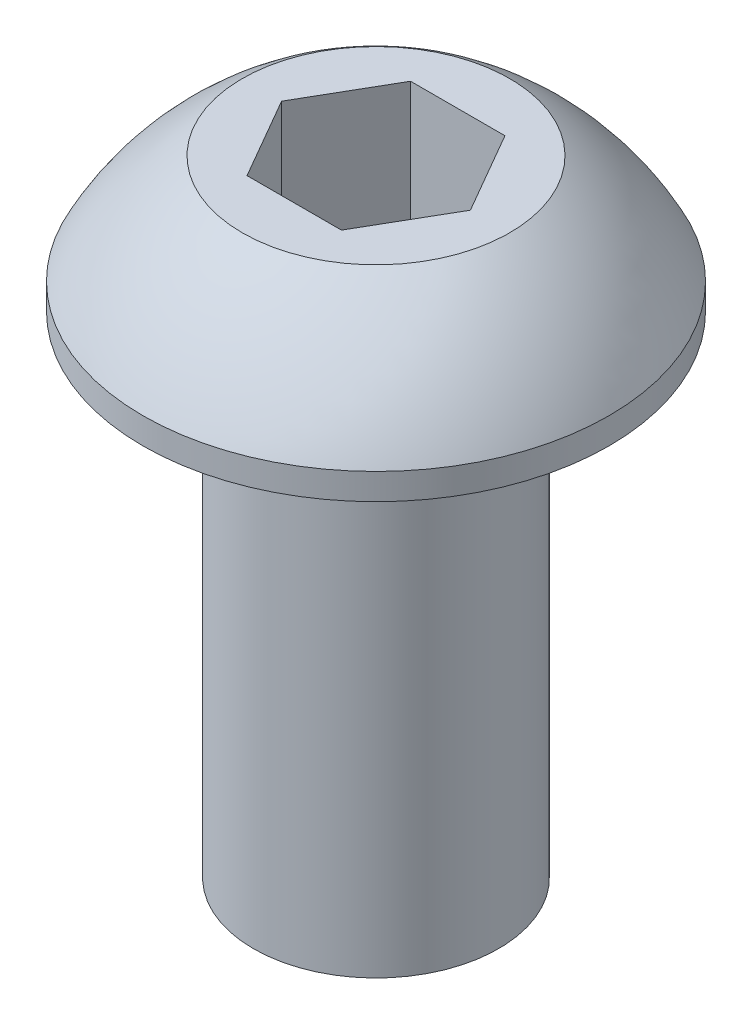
SolidWorks part; units mm, degrees
ref_plane "Front" through (0, 0, 0) normal (0, 0, 1) x (1, 0, 0)
ref_plane "Top" through (0, 0, 0) normal (0, 1, 0) x (1, 0, 0)
ref_plane "Right" through (0, 0, 0) normal (1, 0, 0) x (0, 0, -1)
sketch "profiile" plane through (0, 0, 0) normal (0, 0, 1) x (1, 0, 0)
  line L0 (0, 9.9072) -> (0, -20.7151) construction
  line L1 (0, 1.65) -> (1.635, 1.65)
  line L2 (2.85, 0.3202) -> (2.85, 0)
  line L3 (2.85, 0) -> (1.5, 0)
  line L4 (1.5, 0) -> (1.5, -6)
  line L5 (1.5, -6) -> (0, -6)
  line L6 (0, -6) -> (0, 1.65)
  arc A0 (1.635, 1.65) -> (2.85, 0.3202) centre (-0.1518, -1.2026) cw
  dimension "D1" = 5.7
  dimension "D2" = 1.65
  dimension "thread_length" = 6
  dimension "D4" = 3
revolve "Base-Revolve" add sketch "profiile" angle 360 about L0
sketch "Sketch1" plane through (0, 1.65, 0) normal (0, 1, 0) x (-1, 0, 0)
  line L0 (0, 0) -> (1.1547, 0) construction
  line L1 (0, 0) -> (0.5774, 1) construction
  line L2 (1.1547, 0) -> (0.5774, 1)
  line L3 (1.1547, 0) -> (0.5774, -1)
  line L4 (-0.5774, -1) -> (0.5774, -1)
  line L5 (-0.5774, -1) -> (-1.1547, 0)
  line L6 (-0.5774, 1) -> (-1.1547, 0)
  line L7 (-0.5774, 1) -> (0.5774, 1)
  dimension "D1" = 60
  dimension "D2" = 2
extrude "Cut-Extrude1" cut sketch "Sketch1" against normal blind 1.524
